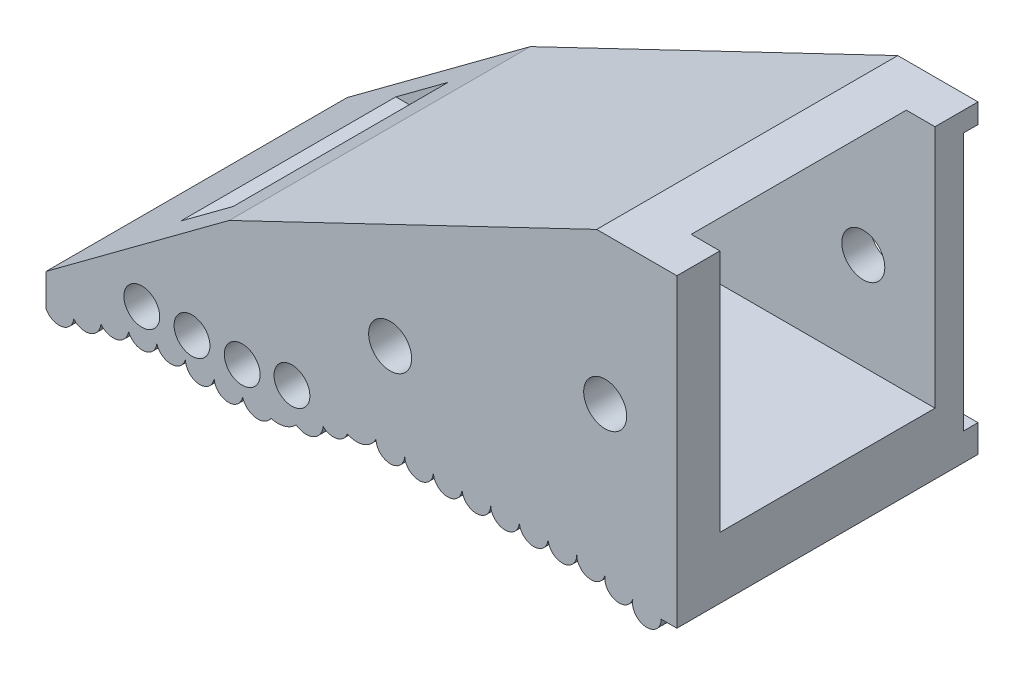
SolidWorks part; units mm, degrees
ref_plane "前视基准面" through (0, 0, 0) normal (0, 0, 1) x (1, 0, 0)
ref_plane "上视基准面" through (0, 0, 0) normal (0, 1, 0) x (1, 0, 0)
ref_plane "右视基准面" through (0, 0, 0) normal (1, 0, 0) x (0, 0, -1)
sketch "草图1" plane through (0, 0, 0) normal (0, 0, 1) x (1, 0, 0)
  line L1 (-12.7783, 7.5679) -> (31.2217, 7.5679)
  line L2 (-12.7783, 7.5679) -> (-12.7783, -17.4321)
  line L3 (-12.7783, -17.4321) -> (31.2217, -17.4321)
  line L4 (31.2217, 7.5679) -> (31.2217, -17.4321)
  dimension "D1" = 44
  dimension "D2" = 25
extrude "凸台-拉伸1" add sketch "草图1" along normal blind 3
sketch "草图2" plane through (0, 0, 3) normal (0, 0, 1) x (1, 0, 0)
  line L1 (31.2217, 7.5679) -> (-12.7783, 7.5679) construction
  line L3 (-8.7783, -9.4321) -> (31.2217, -9.4321)
  line L4 (31.2217, -17.4321) -> (31.2217, 7.5679) construction
  line L5 (31.2217, -9.4321) -> (31.2217, -17.4321)
  line L6 (31.2217, -17.4321) -> (-12.7783, -17.4321)
  line L7 (-12.7783, 7.5679) -> (-12.7783, -17.4321) construction
  line L8 (-12.7783, -17.4321) -> (31.2217, -17.4321) construction
  line L9 (-12.7783, -17.4321) -> (-12.7783, 7.5679)
  line L10 (-12.7783, 7.5679) -> (29.2217, 7.5679)
  line L11 (29.2217, 7.5679) -> (-8.7783, -9.4321)
  dimension "D1" = 4
  dimension "D2" = 8
  dimension "D3" = 2
extrude "凸台-拉伸2" add sketch "草图2" along normal blind 15
sketch "草图3" plane through (0, 0, 18) normal (0, 0, 1) x (1, 0, 0)
  line L1 (-12.7783, 7.5679) -> (31.2217, 7.5679)
  line L2 (-12.7783, 7.5679) -> (-12.7783, -17.4321)
  line L3 (-12.7783, -17.4321) -> (31.2217, -17.4321)
  line L4 (31.2217, 7.5679) -> (31.2217, -17.4321)
extrude "凸台-拉伸3" add sketch "草图3" along normal blind 3
sketch "草图4" plane through (0, 0, 21) normal (0, 0, 1) x (1, 0, 0)
  line L6 (0, -4.7041) -> (-12.7783, -14.1708)
  line L8 (25.6269, 7.5679) -> (31.2217, 7.5679)
  line L12 (25.6269, 7.5679) -> (0, -4.7041)
  line L13 (-12.7783, -14.1708) -> (-12.7783, -16.4321)
  line L14 (-12.7783, 7.5679) -> (-12.7783, -17.4321) construction
  line L17 (31.2217, 7.5679) -> (31.2217, -13.7246)
  line L18 (31.2217, -17.4321) -> (31.2217, 7.5679) construction
  line L19 (31.2217, -13.7246) -> (30.1249, -13.7246)
  arc A11 (2.9101, -15.2004) -> (4.6742, -14.7195) centre (3.3889, -13.4805) ccw
  arc A12 (4.6742, -14.7195) -> (6.5533, -13.8712) centre (5.3699, -13.7551) ccw
  arc A13 (6.5533, -13.8712) -> (8.238, -13.4765) centre (7.2648, -13.1151) ccw
  arc A15 (10.2375, -12.7859) -> (12.2375, -12.7859) centre (11.2375, -12.7859) ccw
  arc A16 (12.2375, -12.7859) -> (14.2375, -12.7859) centre (13.2375, -12.7859) ccw
  arc A17 (14.2375, -12.7859) -> (16.2375, -12.7859) centre (15.2375, -12.7859) ccw
  arc A18 (16.2375, -12.7859) -> (18.2375, -12.7859) centre (17.2375, -12.7859) ccw
  arc A19 (18.2375, -12.7859) -> (20.2375, -12.7859) centre (19.2375, -12.7859) ccw
  arc A20 (20.2375, -12.7859) -> (22.2375, -12.7859) centre (21.2375, -12.7859) ccw
  arc A21 (22.2375, -12.7859) -> (24.2375, -12.7859) centre (23.2375, -12.7859) ccw
  arc A22 (24.2375, -12.7859) -> (26.2143, -13) centre (25.2375, -12.7859) ccw
  arc A23 (26.2143, -13) -> (28.158, -13.4693) centre (27.1911, -13.214) ccw
  arc A24 (28.158, -13.4693) -> (30.1249, -13.7246) centre (29.1249, -13.7246) ccw
  arc A28 (-1.0501, -14.6831) -> (0.9345, -14.8905) centre (-0.0508, -14.72) ccw
  arc A35 (0.9345, -14.8905) -> (2.9101, -15.2004) centre (1.9898, -14.6152) ccw
  arc A36 (-3.0488, -14.6135) -> (-1.0501, -14.6831) centre (-2.0494, -14.6462) ccw
  arc A38 (10.2375, -12.7859) -> (8.238, -13.4765) centre (8.8925, -12.1314) cw
  arc A39 (-12.7783, -16.4321) -> (-10.8413, -16.0829) centre (-11.8679, -15.935) ccw
  arc A40 (-10.8413, -16.0829) -> (-8.9516, -15.4295) centre (-10.0391, -15.3435) ccw
  arc A41 (-8.9516, -15.4295) -> (-7.0177, -14.9176) centre (-8.0938, -14.7614) ccw
  arc A42 (-5.0491, -14.6666) -> (-7.0177, -14.9176) centre (-6.0639, -14.5532) cw
  arc A43 (-5.0491, -14.6666) -> (-3.0488, -14.6135) centre (-4.056, -14.3757) ccw
  dimension "D19" = 2
  dimension "D21" = 2
  dimension "D25" = 2
  dimension "D26" = 2
  dimension "D24" = 2
  dimension "D28" = 2
  dimension "D30" = 2
  dimension "D31" = 2
  dimension "D32" = 2
  dimension "D27" = 2
  dimension "D29" = 2
sketch "草图5" plane through (0, 0, 21) normal (0, 0, 1) x (1, 0, 0)
  line L0 (31.2217, -17.4321) -> (31.2217, 7.5679) construction
  line L1 (31.2217, 7.5679) -> (-12.7783, 7.5679) construction
  circle A0 centre (26.2217, -2.6821) radius 1.5
  dimension "D1" = 5
  dimension "D2" = 10.25
extrude "切除-拉伸1" cut sketch "草图4" against normal blind 30 flip side to cut
extrude "切除-拉伸2" cut sketch "草图5" against normal blind 30
sketch "草图6" plane through (0, 0, 21) normal (0, 0, 1) x (1, 0, 0)
  circle A0 centre (11.2217, -6.6821) radius 1.5
  circle A1 centre (26.2217, -2.6821) radius 1.5 construction
  dimension "D1" = 4
  dimension "D2" = 15
extrude "切除-拉伸3" cut sketch "草图6" against normal blind 30
sketch "草图8" plane through (0, 0, 21) normal (0, 0, 1) x (1, 0, 0)
  line L0 (0, -4.7041) -> (-12.7783, -14.1708) construction
  circle A0 centre (-6.0953, -12.9533) radius 1.25
  circle A1 centre (-2.5953, -12.9533) radius 1.25
  circle A2 centre (0.9047, -12.9533) radius 1.25
  circle A3 centre (4.3736, -12.488) radius 1.25
  dimension "D1" = 3
  dimension "D2" = 3.5
  dimension "D3" = 3.5
  dimension "D4" = 3.5
extrude "切除-拉伸7" cut sketch "草图8" against normal blind 30
sketch "草图9" plane through (0, 0, 0) normal (0, 0, -1) x (-1, 0, 0)
  line L0 (-31.2217, -13.7246) -> (-31.2217, 7.5679) construction
  line L1 (-31.2217, -11.8056) -> (-23.2217, -11.8056)
  line L2 (-31.2217, -11.8056) -> (-31.2217, 6.1944)
  line L3 (-31.2217, 6.1944) -> (-23.2217, 6.1944)
  line L4 (-23.2217, -11.8056) -> (-23.2217, 6.1944)
  line L5 (-25.6269, 7.5679) -> (0, -4.7041) construction
  dimension "D1" = 18
  dimension "D2" = 8
  dimension "D3" = 0.2
extrude "切除-拉伸8" cut sketch "草图9" against normal blind 1
